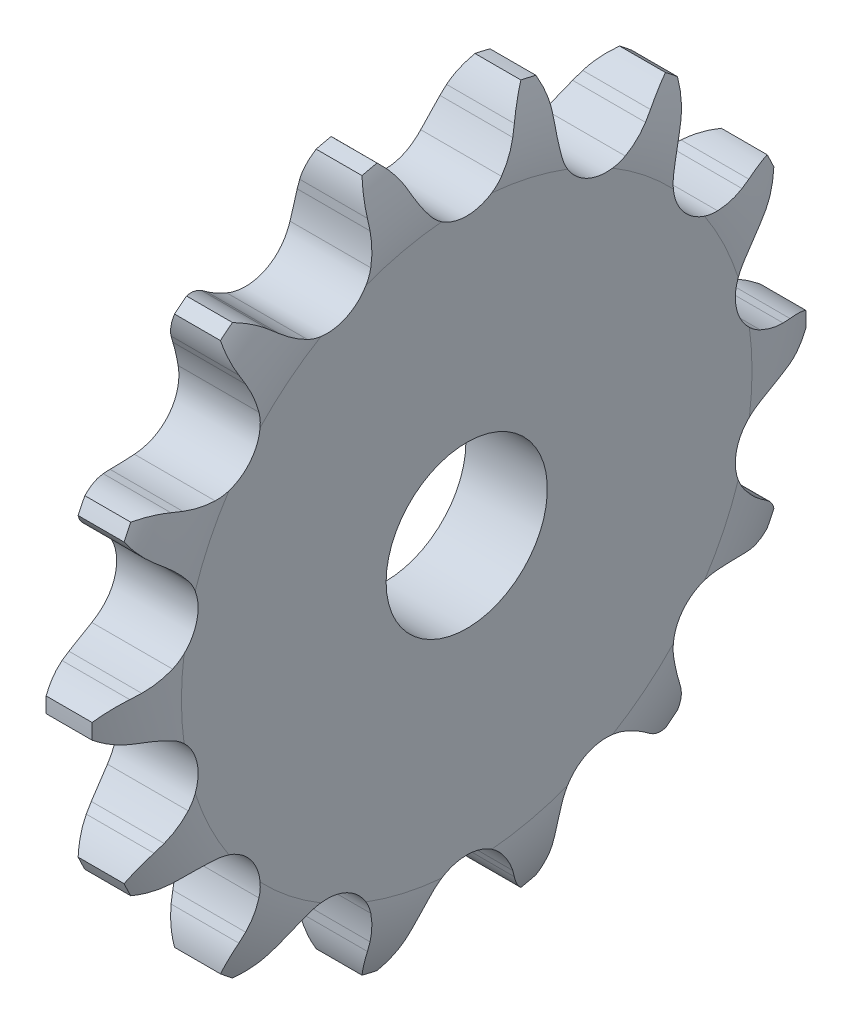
SolidWorks part; units mm, degrees
ref_plane "Plane1" through (0, 0, 0) normal (0, 0, 1) x (1, 0, 0)
ref_plane "Plane2" through (0, 0, 0) normal (0, 1, 0) x (1, 0, 0)
ref_plane "Plane3" through (0, 0, 0) normal (1, 0, 0) x (0, 0, -1)
sketch "Clipboard" plane through (0, 0, 0) normal (0, 1, 0) x (1, 0, 0)
  line L0 (0, 0) -> (12.3228, -3.0724)
  line L1 (-15, 0) -> (100, 0) construction
  line L2 (0, 0) -> (-1.0435, 1.1794)
  line L3 (0, 0) -> (-5.9315, 2.2671)
  line L4 (0, 0) -> (7.6894, 1.9172)
  line L5 (0, 0) -> (-47.5972, -17.7524)
  line L6 (0, 0) -> (-5.9832, -4.0369)
  line L7 (-1.0435, 1.1794) -> (48.0256, 14.3274)
  line L8 (-76.2, 38.1) -> (-60.3758, 38.1)
  line L9 (-73.2057, 38.5609) -> (-73.0533, 38.5634)
  line L10 (-73.0533, 76.1892) -> (-58.6769, 76.1892)
  circle A0 centre (0, 0) radius 3.9624
  circle A1 centre (0, 0) radius 21.0902
  circle A2 centre (0, 0) radius 38.1
  dimension "Dr" = 7.9248
  dimension "MHD" = 42.1803
  dimension "Hub_dia" = 76.2
  dimension "Num_teeth" = 14
  dimension "Pitch" = 12.7
  dimension "Width" = 7.9248
  dimension "Chamfer_wid" = 1.5748
  dimension "Chamfer_dep" = 6.35
  dimension "Overall_len" = 50.8
  dimension "Show_teeth" = 14
  dimension "Thickness" = 7.2177
  dimension "OAL" = 50.8001
  dimension "T_dim" = 15.8242
  dimension "Width_const" = 0.1524
  dimension "Width_factor" = 0.93
  dimension "Num_strands" = 1
  dimension "Transv_pitch" = 14.3764
sketch "BasProSke" plane through (0, 0, 0) normal (0, 1, 0) x (1, 0, 0)
  line L0 (-10, 0) -> (60, 0) construction
  line L1 (0, 0) -> (0, 25.2812)
  line L2 (0, 0) -> (7.2177, 0)
  line L3 (7.2177, 0) -> (7.2177, 25.2812)
  line L4 (5.6429, 31.6312) -> (1.5748, 31.6312)
  arc A0 (0, 25.2812) -> (1.5748, 31.6312) centre (13.5898, 25.2812) cw
  arc A1 (7.2177, 25.2812) -> (5.6429, 31.6312) centre (-6.3722, 25.2812) ccw
  dimension "D1" = 13.5898
  dimension "G1" = 1.5748
  dimension "G2" = 1.5748
  dimension "H2" = 6.35
  dimension "Diameter" = 63.2623
  dimension "H1" = 6.35
  dimension "Thickness" = 7.2177
revolve "Base-Revolve" add sketch "BasProSke" angle 360 about L0
sketch "GrvSke" plane through (0, 0, 0) normal (0, 1, 0) x (1, 0, 0)
  line L0 (7.2177, 25.2812) -> (7.2177, 21.0902)
  line L1 (7.2177, 21.0902) -> (14.3764, 21.0902)
  line L2 (14.3764, 21.0902) -> (14.3764, 25.2812)
  line L3 (5.6429, 31.6312) -> (15.9512, 31.6312)
  line L4 (10.797, 0) -> (10.797, 52.07) construction
  line L5 (-10, 0) -> (60, 0) construction
  line L6 (0, 0) -> (35.56, 0) construction
  arc A0 (14.3764, 25.2812) -> (15.9512, 31.6312) centre (27.9662, 25.2812) cw
  arc A1 (7.2177, 25.2812) -> (5.6429, 31.6312) centre (-6.3722, 25.2812) ccw
  dimension "Diameter" = 63.2623
  dimension "H1" = 6.35
  dimension "Grv_diam" = 42.1803
  dimension "Grv_width" = 7.1587
  dimension "Offset" = 10.797
  dimension "G1" = 1.5748
revolve "Groove" [suppressed] cut sketch "GrvSke" angle 360 about L6
pattern_linear "Grooves" [suppressed]
sketch "TooCutSke" plane through (0, 0, 0) normal (1, 0, 0) x (0, 0, -1)
  line L0 (4.4605, 28.1258) -> (4.8253, 28.898)
  line L1 (0, 0) -> (0, 107) construction
  line L2 (0, 28.5366) -> (-10, 28.5366) construction
  line L3 (-4.4605, 28.1258) -> (-4.8253, 28.898)
  arc A0 (3.1117, 25.991) -> (4.4605, 28.1258) centre (-4.907, 32.551) ccw
  arc A1 (3.1117, 25.991) -> (-3.1117, 25.991) centre (0, 28.5366) cw
  arc A2 (4.8253, 28.898) -> (10.8166, 32.6939) centre (10.8166, 26.0678) cw
  arc A3 (-3.1117, 25.991) -> (-4.4605, 28.1258) centre (4.907, 32.551) cw
  arc A4 (-4.8253, 28.898) -> (-10.8166, 32.6939) centre (-10.8166, 26.0678) ccw
  arc A5 (10.8166, 32.6939) -> (-10.8166, 32.6939) centre (0, 0) ccw
  dimension "R" = 4.0203
  dimension "E" = 10.3602
  dimension "F" = 6.6261
  dimension "Pitch_radius" = 28.5366
  dimension "W" = 10.8166
  dimension "V" = 2.4688
  dimension "A" = 39.286
  dimension "B" = 14
extrude "ToothCut" cut sketch "TooCutSke" along normal through all
pattern_circular "TeethCuts" count 14 every 25.714 about axis through (-10, 0, 0) along (1, 0, 0) of "ToothCut"
sketch "HubNeaOneSke" plane through (0, 0, 0) normal (-1, 0, 0) x (0, 0, 1)
  circle A0 centre (0, 0) radius 21.0902
  dimension "Diameter" = 42.1803
extrude "HubNearOne" [suppressed] add sketch "HubNeaOneSke" along normal blind 43.5824
sketch "HubNeaBotSke" plane through (0, 0, 0) normal (-1, 0, 0) x (0, 0, 1)
  circle A0 centre (0, 0) radius 21.0902
  dimension "Diameter" = 42.1803
extrude "HubNearBoth" [suppressed] add sketch "HubNeaBotSke" along normal blind 21.7912
ref_plane "FarPln" through (7.2177, 0, 0) normal (1, 0, 0) x (0, 0, -1)
sketch "HubFarSke" plane through (7.2177, 0, 0) normal (1, 0, 0) x (0, 0, -1)
  circle A0 centre (0, 0) radius 21.0902
  dimension "Diameter" = 42.1803
extrude "HubFar" [suppressed] add sketch "HubFarSke" along normal blind 21.7912
sketch "BorSke" plane through (0, 0, 0) normal (1, 0, 0) x (0, 0, -1)
  circle A0 centre (0, 0) radius 7.1438
  dimension "Diameter" = 14.2875
extrude "Bore" cut sketch "BorSke" along normal mid plane 101.6001
sketch "KeySke" plane through (0, 0, 0) normal (1, 0, 0) x (0, 0, -1)
  line L0 (-1.5875, 0) -> (-1.5875, 8.6804)
  line L1 (-1.5875, 8.6804) -> (1.5875, 8.6804)
  line L2 (1.5875, 8.6804) -> (1.5875, 0)
  line L3 (0, 0) -> (0, 34) construction
  line L4 (-1.5875, 0) -> (1.5875, 0)
  dimension "Offset" = 8.6804
  dimension "Width" = 3.175
extrude "Keyway" [suppressed] cut sketch "KeySke" along normal mid plane 101.6001
pattern_circular "Keyway2" [suppressed] count 2 every 90 about axis through (-10, 0, 0) along (1, 0, 0)
ref_plane "Plane4" through (3.175, 0, 0) normal (1, 0, 0) x (0, 0, -1)
sketch "Sk-chain_circle" plane through (3.175, 0, 0) normal (1, 0, 0) x (0, 0, -1)
  circle A0 centre (0, 0) radius 28.5366
equation "\"Num_teeth@Clipboard\" = int( \"Num_teeth@Clipboard\" )"
equation "\"Num_teeth@Clipboard\" = ((sgn( \"Num_teeth@Clipboard\" - 5.0)+1)*( \"Num_teeth@Clipboard\" - 5.0))/2 +5.0"
equation "\"Num_teeth@Clipboard\" = ((sgn( \"Num_teeth@Clipboard\" - 200.0)-1)*( \"Num_teeth@Clipboard\" - 200.0))/-2 +200.0"
equation "\"MHD@Clipboard\" = \"Pitch@Clipboard\" * (1.0 / tan(3.14159265 / \"Num_teeth@Clipboard\" ) - 1.0) - 0.03"
equation "\"Thickness@Clipboard\"  = \"Width@Clipboard\" * \"Width_factor@Clipboard\" - \"Width_const@Clipboard\" + (\"Num_strands@Clipboard\" - 1) * \"Transv_pitch@Clipboard\""
equation "\"OAL@Clipboard\" = \"Thickness@Clipboard\""
equation "\"MHD@Clipboard\" = ((sgn( \"MHD@Clipboard\" - \"Hub_dia@Clipboard\" )-1)*( \"MHD@Clipboard\" - \"Hub_dia@Clipboard\" ))/-2+ \"Hub_dia@Clipboard\""
equation "\"OAL@Clipboard\" = ((sgn( \"OAL@Clipboard\" - \"Overall_len@Clipboard\" )+1)*( \"OAL@Clipboard\" - \"Overall_len@Clipboard\" ))/2 + \"Overall_len@Clipboard\" + 0.000002"
equation "\"Num_teeth@TeethCuts\" = int( \"Show_teeth@Clipboard\" ) + 1"
equation "\"Num_teeth@TeethCuts\" = ((sgn( \"Num_teeth@TeethCuts\" - \"Num_teeth@Clipboard\" )-1)*( \"Num_teeth@TeethCuts\" - \"Num_teeth@Clipboard\" ))/-2+ \"Num_teeth@Clipboard\""
equation "\"Num_teeth@TeethCuts\" = ((sgn( \"Num_teeth@TeethCuts\" - 2.0)+1)*( \"Num_teeth@TeethCuts\" - 2.0))/2 +2.0"
equation "\"Angle@TeethCuts\" = 360.0 / \"Num_teeth@Clipboard\""
equation "\"Pitch_radius@TooCutSke\" = ( \"Pitch@Clipboard\" / 2.0) / sin(3.14159265 / \"Num_teeth@Clipboard\" )  'ma"
equation "\"R@TooCutSke\"  = \"Dr@Clipboard\" * 0.5025 + 0.0015"
equation "\"A@TooCutSke\" = 35.0 + (60.0 / \"Num_teeth@Clipboard\")"
equation "\"E@TooCutSke\"  = \"Dr@Clipboard\" * 1.3025 + 0.0015"
equation "\"B@TooCutSke\"  = 18.0 - (56.0 / \"Num_teeth@Clipboard\" )"
equation "\"W@TooCutSke\" = 1.4 * \"Dr@Clipboard\" * cos(3.14159265 / \"Num_teeth@Clipboard\" )"
equation "\"V@TooCutSke\" = 1.4 * \"Dr@Clipboard\" * sin(3.14159265 / \"Num_teeth@Clipboard\" )"
equation "\"Diameter@BasProSke\" = 2.0 * ( (0.3 * \"Pitch@Clipboard\" ) +  \"Pitch@Clipboard\" / 2.0 / tan(3.14159265 / \"Num_teeth@Clipboard\" ))"
equation "\"Thickness@BasProSke\"  = \"Thickness@Clipboard\""
equation "\"G1@BasProSke\" =  \"Chamfer_wid@Clipboard\""
equation "\"G2@BasProSke\" =  \"Chamfer_wid@Clipboard\""
equation "\"H1@BasProSke\" =  \"Chamfer_dep@Clipboard\""
equation "\"H2@BasProSke\" =  \"Chamfer_dep@Clipboard\""
equation "\"Diameter@GrvSke\" = \"Diameter@BasProSke\""
equation "\"G1@GrvSke\" = \"Chamfer_wid@Clipboard\""
equation "\"H1@GrvSke\" = \"Chamfer_dep@Clipboard\""
equation "\"Grv_diam@GrvSke\" =  \"Pitch@Clipboard\" * (1.0 / tan(3.14159265 / \"Num_teeth@Clipboard\" ) - 1.0) - 0.03"
equation "\"Grv_width@GrvSke\" =  \"Transv_pitch@Clipboard\" - ( \"Width@Clipboard\" * \"Width_factor@Clipboard\" - \"Width_const@Clipboard\" )"
equation "\"Offset@GrvSke\" = \"Grv_width@GrvSke\" / 2.0 + ( \"Width@Clipboard\" * \"Width_factor@Clipboard\" - \"Width_const@Clipboard\" )"
equation "\"Offset@Grooves\" = \"Transv_pitch@Clipboard\""
equation "\"Num_grvs@Grooves\" = \"Num_strands@Clipboard\""
equation "\"Num_grvs@Grooves\" = \"Num_grvs@Grooves\" - 1 * sgn( \"Num_grvs@Grooves\" -1)"
equation "\"Diameter@HubNeaOneSke\" = \"MHD@Clipboard\""
equation "\"Length@HubNearOne\" = \"OAL@Clipboard\" - \"Thickness@BasProSke\""
equation "\"Diameter@HubNeaBotSke\" = \"MHD@Clipboard\""
equation "\"Length@HubNearBoth\" = ( \"OAL@Clipboard\" - \"Thickness@BasProSke\" ) / 2.0"
equation "\"Thickness@FarPln\" = \"Thickness@BasProSke\""
equation "\"Diameter@HubFarSke\" = \"MHD@Clipboard\""
equation "\"Length@HubFar\" = ( \"OAL@Clipboard\" - \"Thickness@BasProSke\" ) / 2.0"
equation "\"D1@Bore\" = \"OAL@Clipboard\" * 2.0"
equation "\"D1@Keyway\" = \"OAL@Clipboard\" * 2.0"
equation "\"Offset@KeySke\" = \"T_dim@Clipboard\" - \"Diameter@BorSke\" / 2.0"
